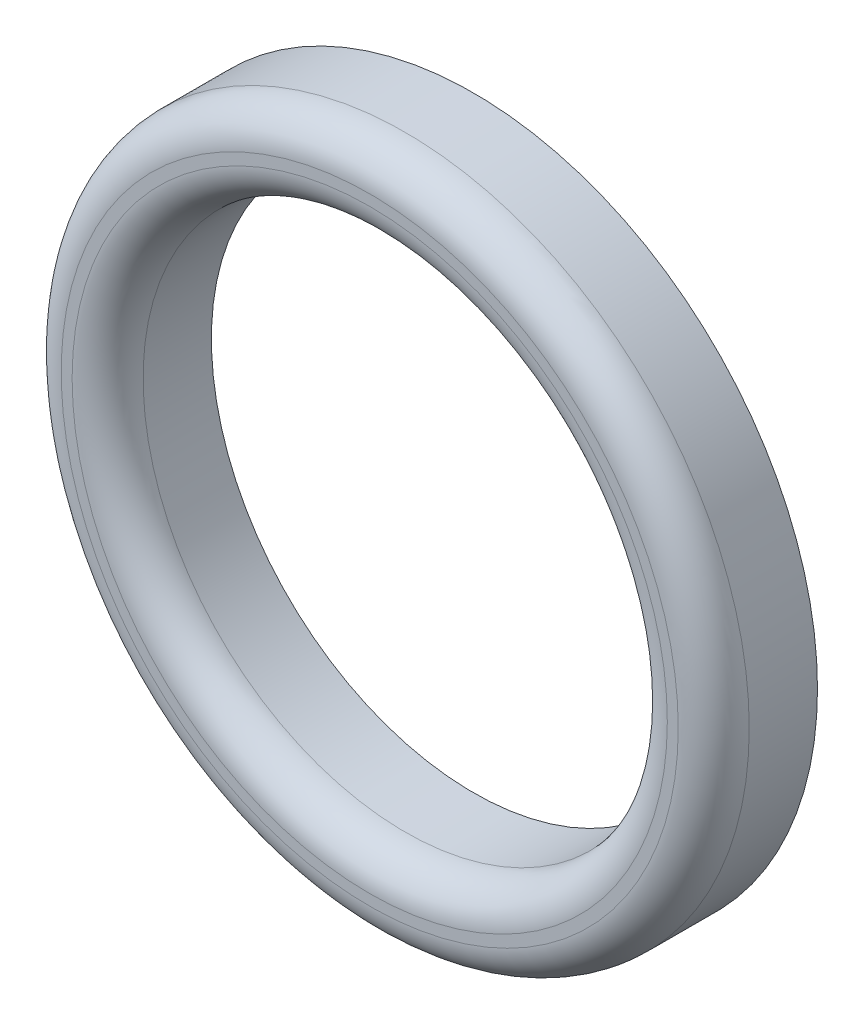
SolidWorks part; units mm, degrees
ref_plane "Front Plane" through (0, 0, 0) normal (0, 0, 1) x (1, 0, 0)
ref_plane "Top Plane" through (0, 0, 0) normal (0, 1, 0) x (1, 0, 0)
ref_plane "Right Plane" through (0, 0, 0) normal (1, 0, 0) x (0, 0, -1)
sketch "Sketch1" plane through (0, 0, 0) normal (0, 0, 1) x (1, 0, 0)
  circle A0 centre (0, 0) radius 12
  circle A1 centre (0, 0) radius 15.75
extrude "Boss-Extrude1" add sketch "Sketch1" along normal blind 4.75
fillet "Fillet1" radius 1.625 2 edges at (15.75, 0, 4.75) (12, 0, 4.75)
